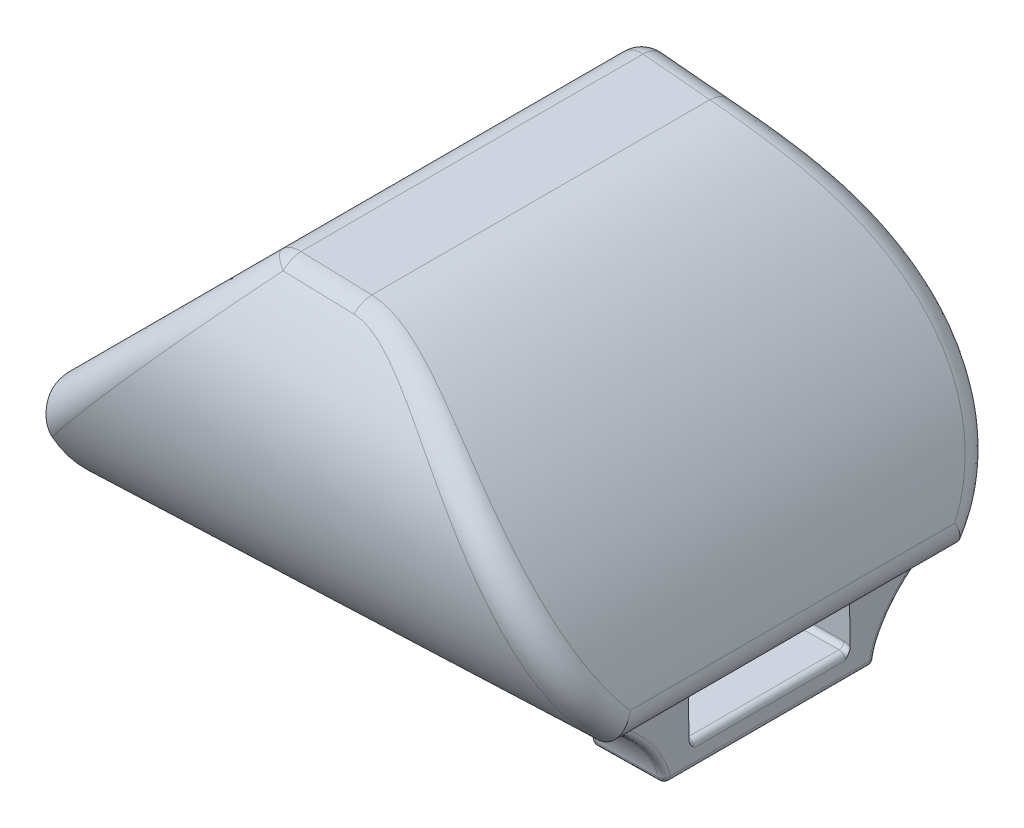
SolidWorks part; units mm, degrees
ref_plane "Front Plane" through (0, 0, 0) normal (0, 0, 1) x (1, 0, 0)
ref_plane "Top Plane" through (0, 0, 0) normal (0, 1, 0) x (1, 0, 0)
ref_plane "Right Plane" through (0, 0, 0) normal (1, 0, 0) x (0, 0, -1)
sketch "Sketch2" plane through (0, 0, 0) normal (1, 0, 0) x (0, 0, -1)
  line L0 (0, 0) -> (15.08, 0)
  line L2 (15.08, -11.76) -> (0, -11.76)
  line L4 (7.54, 0) -> (7.54, -11.76) construction
  arc A0 (15.08, 0) -> (15.08, -11.76) centre (9.5236, -5.88) cw
  arc A1 (0, 0) -> (0, -11.76) centre (5.5564, -5.88) ccw
  dimension "D3" = 8.09
  dimension "D1" = 15.08
  dimension "D2" = 11.76
ref_plane "Plane1" through (21, 0, 0) normal (1, 0, 0) x (0, 0, -1)
sketch "Sketch3" plane through (21, 0, 0) normal (1, 0, 0) x (0, 0, -1)
  line L0 (0.615, -1.26) -> (14.465, -1.26)
  line L2 (14.465, -11.46) -> (0.615, -11.46)
  line L4 (7.54, -1.26) -> (7.54, -11.46) construction
  line L5 (15.08, -11.76) -> (0, -11.76) construction
  line L6 (7.54, 0) -> (7.54, -11.76) construction
  arc A0 (0.615, -1.26) -> (0.615, -11.46) centre (5.307, -6.36) ccw
  arc A1 (14.465, -1.26) -> (14.465, -11.46) centre (9.773, -6.36) cw
  dimension "D3" = 6.93
  dimension "D1" = 13.85
  dimension "D2" = 10.2
  dimension "D4" = 0.3
loft "Loft1" add profiles "Sketch2", "Sketch3"
chamfer "Chamfer1" distance 7.88 angle 45 1 edges
fillet "Fillet1" radius 11 1 edges
fillet "Fillet2" radius 1 9 edges at (5.1525, -2.7275, 1.592) (3.6106, -4.2694, -17.2732) (7.434, -0.446, -7.54)
ref_plane "Plane2" through (0.168, -11.7576, 0) normal (0.0143, -0.9999, 0) x (-0.9999, -0.0143, 0)
sketch "Sketch4" plane through (0.168, -11.7576, 0) normal (0.0143, -0.9999, 0) x (-0.9999, -0.0143, 0)
  line L0 (-19.694, 11.79) -> (-16.694, 11.79)
  line L1 (-19.694, 14.4984) -> (-19.694, 0.5816) construction
  line L2 (-16.694, 11.79) -> (-16.694, 3.29)
  line L3 (-16.694, 3.29) -> (-19.694, 3.29)
  line L4 (-19.694, 3.29) -> (-19.694, 11.79)
  line L5 (-16.694, 7.54) -> (0.168, 7.54) construction
  line L6 (0.168, 0) -> (0.168, 15.08) construction
  dimension "D1" = 8.5
  dimension "D2" = 3
extrude "Boss-Extrude1" add sketch "Sketch4" along normal blind 3
ref_plane "Plane3" through (16.6923, 0.2385, 0) normal (-0.9999, -0.0143, 0) x (0, 0, 1)
sketch "Sketch6" plane through (16.6923, 0.2385, 0) normal (-0.9999, -0.0143, 0) x (0, 0, 1)
  line L0 (-10.79, -11.7588) -> (-4.29, -11.7588)
  line L1 (-3.29, -11.7588) -> (-11.79, -11.7588) construction
  line L2 (-4.29, -11.7588) -> (-4.29, -13.7588)
  line L3 (-4.29, -13.7588) -> (-10.79, -13.7588)
  line L4 (-10.79, -13.7588) -> (-10.79, -11.7588)
  line L6 (-7.54, -13.7588) -> (-7.54, -14.7588) construction
  line L7 (-3.29, -14.7588) -> (-11.79, -14.7588) construction
  dimension "D1" = 6.5
  dimension "D2" = 2
extrude "Cut-Extrude1" cut sketch "Sketch6" against normal through all
sketch "Sketch7" plane through (0.168, -11.7576, 0) normal (0.0143, -0.9999, 0) x (-0.9999, -0.0143, 0)
  line L0 (-16.694, 10.79) -> (0.168, 10.79)
  line L1 (0.168, 0) -> (0.168, 15.08) construction
  line L2 (0.168, 10.79) -> (0.168, 4.29)
  line L3 (0.168, 4.29) -> (-16.694, 4.29)
  line L4 (-16.694, 4.29) -> (-16.694, 10.79)
  line L5 (-16.694, 7.54) -> (0.168, 7.54) construction
  line L7 (-16.694, 10.79) -> (-16.694, 4.29) construction
  dimension "D1" = 6.5
extrude "Cut-Extrude2" cut sketch "Sketch7" against normal blind 0.25
fillet "Fillet3" radius 3 4 edges at (19.8599, -11.4763, -13.1442) (19.8599, -11.4763, -1.9358) (18.3601, -11.4977, -3.29) (18.3601, -11.4977, -11.79)
fillet "Fillet9" radius 0.25 2 edges at (19.8885, -13.4761, -7.54) (16.8888, -13.5189, -7.54)
fillet "Fillet10" radius 0.25 3 edges
fillet "Fillet4" radius 0.25 1 edges at (16.8567, -11.2692, -7.54)
fillet "Fillet5" radius 0.2 1 edges at (16.8602, -11.5191, -7.54)
fillet "Fillet6" radius 0.25 10 edges at (19.9604, -11.4698, -4.29) (18.4366, -11.4966, -4.29) (16.9075, -11.4884, -4.29) (16.739, -11.3084, -4.29) (19.9604, -11.4698, -10.79) (18.4366, -11.4966, -10.79) (16.9075, -11.4884, -10.79) (16.739, -11.3084, -10.79) (8.3033, -11.3914, -4.29) (8.3033, -11.3914, -10.79)
fillet "Fillet8" radius 0.2 6 edges at (18.3886, -13.4975, -10.79) (18.3886, -13.4975, -4.29) (19.8163, -13.5503, -10.79) (16.9631, -13.5911, -10.79) (19.8163, -13.5503, -4.29) (16.9631, -13.5911, -4.29)
fillet "Fillet11" radius 0.25 19 edges at (16.8754, -12.5819, -10.79) (16.778, -11.5841, -10.79) (16.8632, -11.7554, -4.29) (16.778, -11.5841, -4.29) (16.9383, -11.7611, -4.29) (16.8632, -11.7554, -10.79) (16.9383, -11.7611, -10.79) (16.7675, -11.4419, -4.3632) (16.9203, -11.5749, -4.3632) (17.0056, -13.3366, -10.79) (16.8754, -12.5819, -4.29) (17.0056, -13.3366, -4.29) (16.8885, -13.4948, -10.7738) (16.8885, -13.4948, -4.3062)
fillet "Fillet12" radius 0.25 23 edges at (19.8954, -13.9605, -11.8854) (16.8958, -14.0105, -3.1956) (19.8887, -13.4901, -2.9838) (16.8876, -13.4339, -12.1559) (19.9198, -11.5389, -0.8688) (20.0467, -11.4564, -0.5772) (19.8948, -11.5757, -14.1112) (16.638, -11.5239, -14.5723) (16.6432, -11.5244, -0.5149)
fillet "Fillet13" radius 0.25 8 edges at (19.8296, -14.477, -3.3632) (19.9028, -14.476, -7.54) (19.8296, -14.477, -11.7168) (18.4029, -14.4974, -11.79) (16.9763, -14.5178, -11.7168) (16.9031, -14.5188, -7.54) (16.9763, -14.5178, -3.3632) (18.4029, -14.4974, -3.29)
